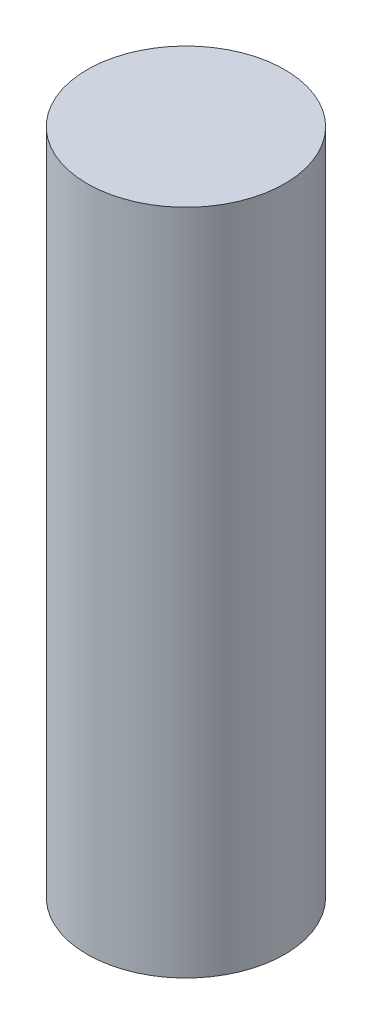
SolidWorks part; units mm, degrees
ref_plane "Front Plane" through (0, 0, 0) normal (0, 0, 1) x (1, 0, 0)
ref_plane "Top Plane" through (0, 0, 0) normal (0, 1, 0) x (1, 0, 0)
ref_plane "Right Plane" through (0, 0, 0) normal (1, 0, 0) x (0, 0, -1)
sketch "Sketch1" plane through (0, 0, 0) normal (0, 1, 0) x (1, 0, 0)
  circle A0 centre (0, 0) radius 7.4
  dimension "D1" = 14.8
extrude "Boss-Extrude1" add sketch "Sketch1" along normal blind 50
